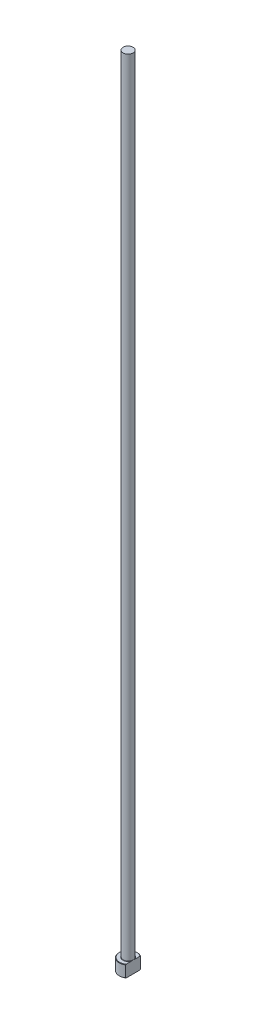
SolidWorks part; units mm, degrees
ref_plane "Front Plane" through (0, 0, 0) normal (0, 0, 1) x (1, 0, 0)
ref_plane "Top Plane" through (0, 0, 0) normal (0, 1, 0) x (1, 0, 0)
ref_plane "Right Plane" through (0, 0, 0) normal (1, 0, 0) x (0, 0, -1)
sketch "Sketch1" plane through (0, 0, 0) normal (0, 0, 1) x (1, 0, 0)
  line L0 (0, 259.9588) -> (0, -15.1925) construction
  line L1 (0, 0) -> (-4.5, 0)
  line L2 (-4.5, 0) -> (-4.5, 6)
  line L3 (-4.5, 6) -> (-2.5, 6)
  line L4 (-2.5, 6) -> (-2.5, 400)
  line L5 (-2.5, 400) -> (0, 400)
  line L6 (0, 400) -> (0, 0)
  dimension "L" = 400
  dimension "H" = 9
  dimension "T" = 6
  dimension "D" = 5
revolve "Revolve1" add sketch "Sketch1" angle 360 about L0
chamfer "Chamfer1" distance 0.2 angle 45 2 edges at (0, 6, 4.5) (0, 0, 4.5)
fillet "Fillet1" radius 0.2 1 edges at (0, 6, 2.5)
sketch "Sketch2" plane through (0, 0, 0) normal (0, 1, 0) x (1, 0, 0)
  line L0 (2.5, -3.7417) -> (2.5, 3.7417)
  circle A0 centre (0, 0) radius 4.5 construction
  arc A1 (2.5, -3.7417) -> (2.5, 3.7417) centre (0, 0) ccw
  circle A2 centre (0, 0) radius 2.5 construction
extrude "KEYED HEAD" cut sketch "Sketch2" along normal through all
